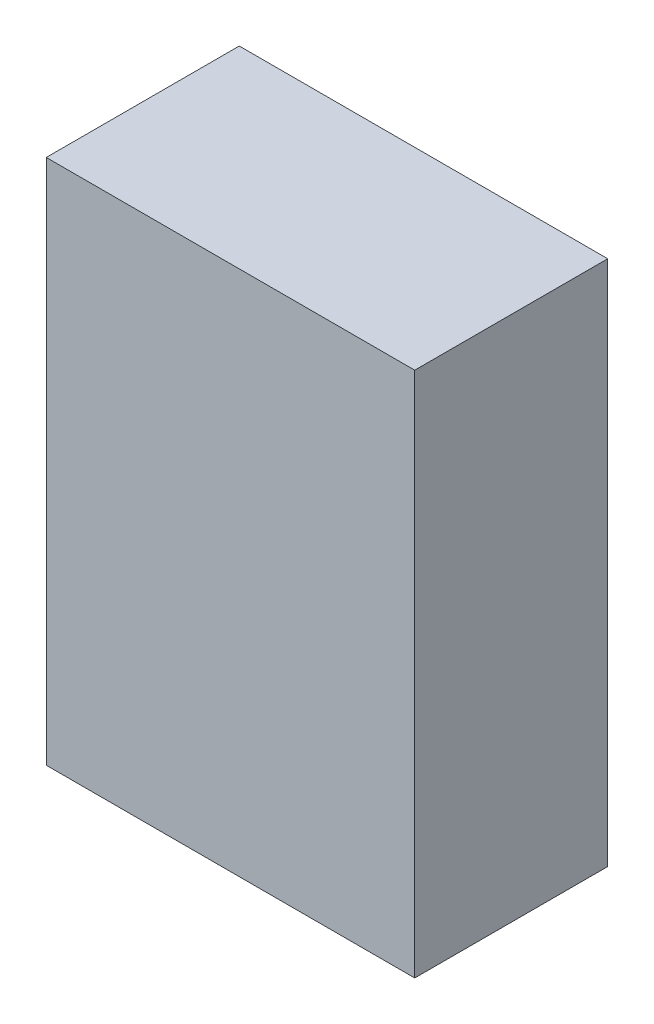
SolidWorks part; units mm, degrees
ref_plane "Front Plane" through (0, 0, 0) normal (0, 0, 1) x (1, 0, 0)
ref_plane "Top Plane" through (0, 0, 0) normal (0, 1, 0) x (1, 0, 0)
ref_plane "Right Plane" through (0, 0, 0) normal (1, 0, 0) x (0, 0, -1)
sketch "GENERAL" plane through (0, 0, 0) normal (0, 0, 1) x (1, 0, 0)
  line L16 (-1.05, -1.5) -> (1.05, -1.5)
  line L17 (1.05, -1.5) -> (1.05, 1.5)
  line L18 (1.05, 1.5) -> (-1.05, 1.5)
  line L19 (-1.05, 1.5) -> (-1.05, -1.5)
extrude "Boss-Extrude1" add sketch "GENERAL" along normal blind 1.1
